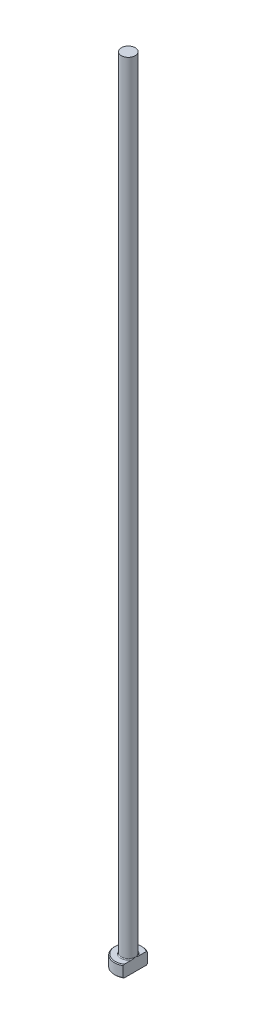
SolidWorks part; units mm, degrees
ref_plane "Front Plane" through (0, 0, 0) normal (0, 0, 1) x (1, 0, 0)
ref_plane "Top Plane" through (0, 0, 0) normal (0, 1, 0) x (1, 0, 0)
ref_plane "Right Plane" through (0, 0, 0) normal (1, 0, 0) x (0, 0, -1)
sketch "Sketch1" plane through (0, 0, 0) normal (0, 0, 1) x (1, 0, 0)
  line L0 (0, 259.9588) -> (0, -15.1925) construction
  line L1 (0, 0) -> (-3.5, 0)
  line L2 (-3.5, 0) -> (-3.5, 3)
  line L3 (-3.5, 3) -> (-1.75, 3)
  line L4 (-1.75, 3) -> (-1.75, 200)
  line L5 (-1.75, 200) -> (0, 200)
  line L6 (0, 200) -> (0, 0)
  dimension "L" = 200
  dimension "H" = 7
  dimension "T" = 3
  dimension "D" = 3.5
revolve "Revolve1" add sketch "Sketch1" angle 360 about L0
chamfer "Chamfer1" distance 0.2 angle 45 2 edges at (0, 3, 3.5) (0, 0, 3.5)
fillet "Fillet1" radius 0.2 1 edges at (0, 3, 1.75)
sketch "Sketch2" plane through (0, 0, 0) normal (0, 1, 0) x (1, 0, 0)
  line L0 (1.75, 3.0311) -> (1.75, -3.0311)
  circle A0 centre (0, 0) radius 3.5 construction
  arc A1 (1.75, -3.0311) -> (1.75, 3.0311) centre (0, 0) ccw
  circle A2 centre (0, 0) radius 1.75 construction
extrude "KEY" cut sketch "Sketch2" along normal through all
